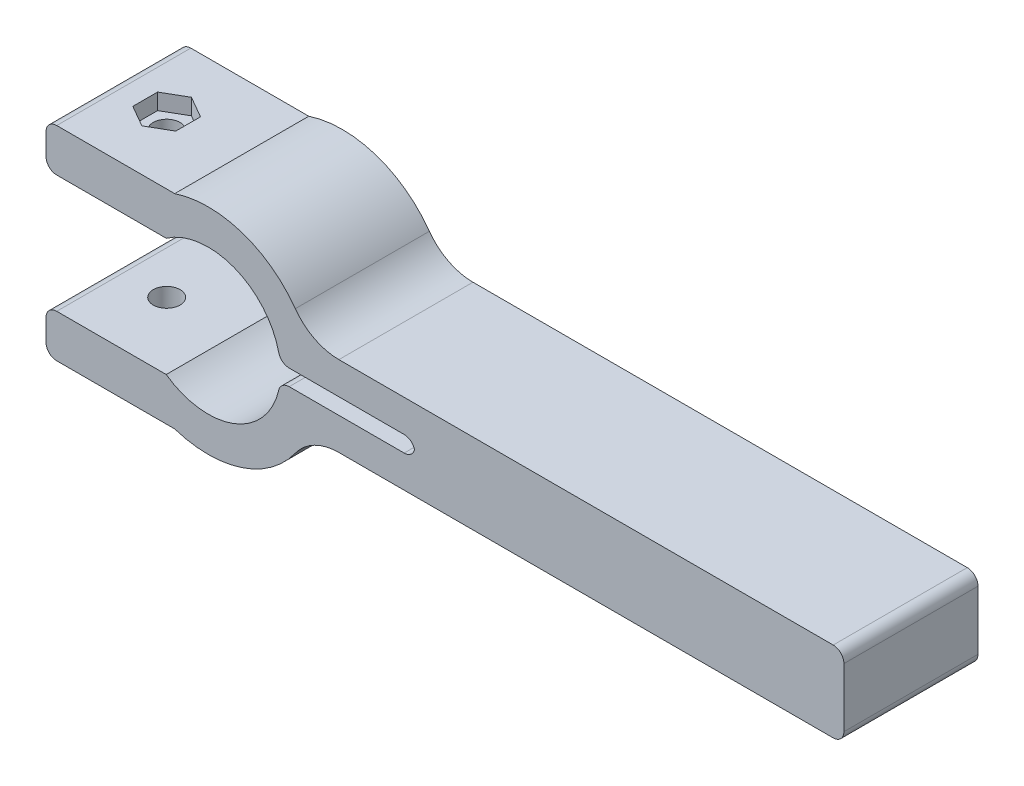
SolidWorks part; units mm, degrees
ref_plane "Спереди" through (0, 0, 0) normal (0, 0, 1) x (1, 0, 0)
ref_plane "Сверху" through (0, 0, 0) normal (0, 1, 0) x (1, 0, 0)
ref_plane "Справа" through (0, 0, 0) normal (1, 0, 0) x (0, 0, -1)
sketch "Эскиз1" plane through (0, 0, 0) normal (0, 0, 1) x (1, 0, 0)
  line L1 (0, 0) -> (-100, 0)
  line L2 (0, 0) -> (0, 15)
  line L3 (0, 15) -> (-100, 15)
  line L8 (-148.7855, -11.5) -> (-148.7855, -3.5)
  line L9 (0, 7.5) -> (-240.7472, 7.5) construction
  line L10 (-148.7855, 18.5) -> (-148.7855, 26.5)
  line L11 (-148.7855, 18.5) -> (-126.3667, 18.5)
  line L13 (-148.7855, -3.5) -> (-126.3667, -3.5)
  line L14 (-124.7855, 26.5) -> (-148.7855, 26.5)
  line L15 (-124.7855, -11.5) -> (-148.7855, -11.5)
  line L17 (-105.1241, 9) -> (-80, 9)
  line L19 (-105.1241, 6) -> (-80, 6)
  line L20 (-80, 9) -> (-80, 6)
  arc A0 (-126.3667, -3.5) -> (-105.1241, 6) centre (-118.5405, 7.5) ccw
  arc A2 (-124.7855, -11.5) -> (-100, 0) centre (-118.5405, 7.5) ccw
  arc A3 (-100, 15) -> (-124.7855, 26.5) centre (-118.5405, 7.5) ccw
  arc A4 (-105.1241, 9) -> (-126.3667, 18.5) centre (-118.5405, 7.5) ccw
  point P20 (-80, 7.5)
  dimension "D2" = 13.5
  dimension "D8" = 3
  dimension "D1" = 20
  dimension "D3" = 15
  dimension "D4" = 22
  dimension "D5" = 100
  dimension "D6" = 38
  dimension "D7" = 24
  dimension "D9" = 80
extrude "Бобышка-Вытянуть1" add sketch "Эскиз1" along normal blind 25
sketch "Эскиз2" plane through (0, 26.5, 0) normal (0, 1, 0) x (1, 0, 0)
  line L0 (-148.7855, -12.5) -> (-124.7855, -12.5) construction
  line L3 (-138.7855, 0) -> (-138.7855, -25) construction
  line L4 (-138.7855, -7.8812) -> (-142.7855, -10.1906)
  line L5 (-142.7855, -10.1906) -> (-142.7855, -14.8094)
  line L6 (-142.7855, -14.8094) -> (-138.7855, -17.1188)
  line L7 (-138.7855, -17.1188) -> (-134.7855, -14.8094)
  line L8 (-134.7855, -14.8094) -> (-134.7855, -10.1906)
  line L9 (-134.7855, -10.1906) -> (-138.7855, -7.8812)
  line L13 (-148.7855, -25) -> (-148.7855, 0) construction
  line L14 (-124.7855, 0) -> (-148.7855, 0) construction
  line L15 (-124.7855, -25) -> (-148.7855, -25) construction
  line L16 (-124.7855, -25) -> (-124.7855, 0) construction
  circle A0 centre (-138.7855, -12.5) radius 4 construction
  dimension "D1" = 8
  dimension "D2" = 10
extrude "Вырез-Вытянуть1" cut sketch "Эскиз2" against normal blind 3
sketch "Эскиз3" plane through (0, 26.5, 0) normal (0, 1, 0) x (1, 0, 0)
  line L0 (-148.7855, -12.5) -> (-124.7855, -12.5) construction
  line L3 (-138.7855, -7.8812) -> (-138.7855, -17.1188) construction
  line L4 (-124.7855, -25) -> (-124.7855, 0) construction
  line L5 (-148.7855, -25) -> (-148.7855, 0) construction
  circle A0 centre (-138.7855, -12.5) radius 2.5
  dimension "D1" = 5
extrude "Вырез-Вытянуть2" cut sketch "Эскиз3" against normal through all
fillet "Скругление1" radius 10 2 edges at (-100, 0, 12.5) (-100, 15, 12.5)
fillet "Скругление2" radius 2 10 edges at (-148.7855, 18.5, 12.5) (-148.7855, -3.5, 12.5) (0, 15, 12.5) (0, 0, 12.5) (-148.7855, -11.5, 12.5) (-148.7855, 26.5, 12.5) (-80, 6, 12.5) (-80, 9, 12.5) (-105.1241, 6, 12.5) (-105.1241, 9, 12.5)
chamfer "Фаска1" distance 2 angle 45 1 edges at (-141.2855, -11.5, 12.5)
